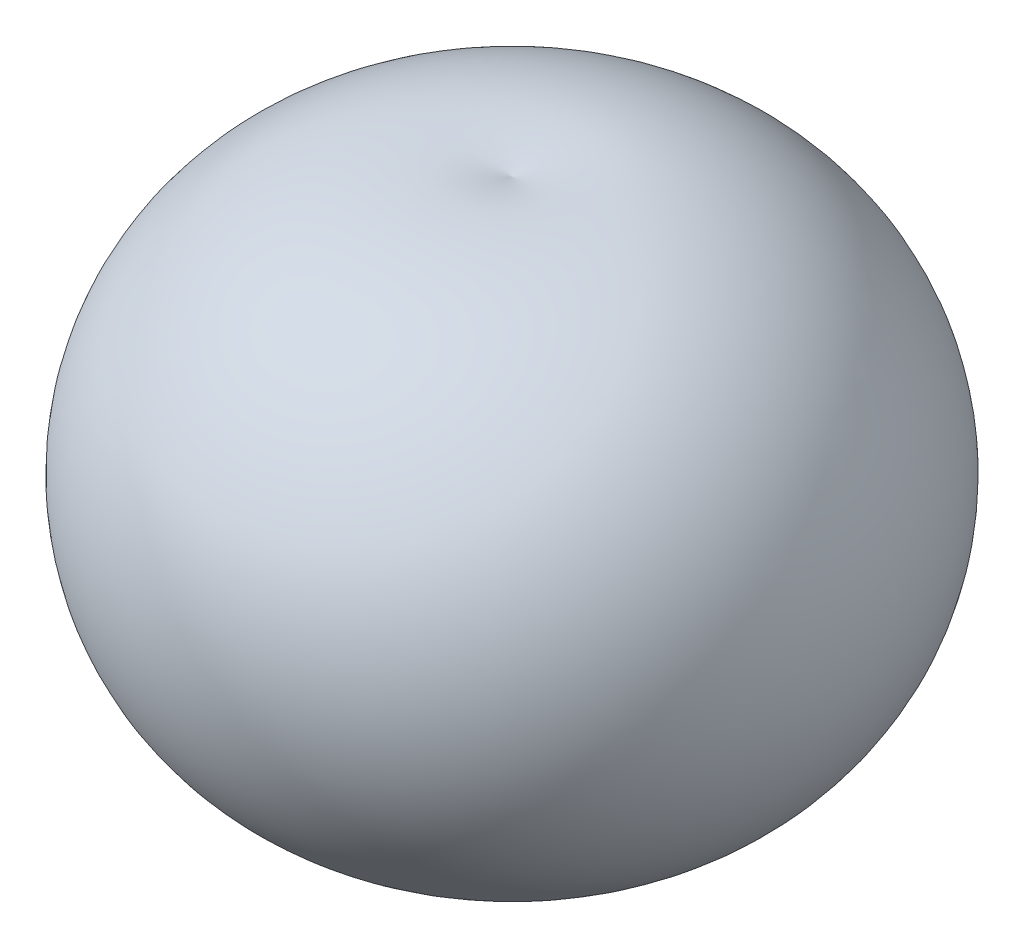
SolidWorks part; units mm, degrees
ref_plane "前视基准面" through (0, 0, 0) normal (0, 0, 1) x (1, 0, 0)
ref_plane "上视基准面" through (0, 0, 0) normal (0, 1, 0) x (1, 0, 0)
ref_plane "右视基准面" through (0, 0, 0) normal (1, 0, 0) x (0, 0, -1)
sketch "草图1" plane through (0, 0, 0) normal (0, 0, 1) x (1, 0, 0)
  line L0 (0, 0) -> (0, 356) construction
  line L1 (0, 356) -> (-500, 356) construction
  line L2 (-500, 356) -> (-500, 966) construction
  line L3 (-500, 356) -> (61.508, 594.346) construction
  line L4 (-500, 356) -> (-805, -172.2755) construction
  line L5 (-500, 966) -> (-1955, 966) construction
  line L6 (61.508, 594.346) -> (-507.0058, 1933.6806) construction
  line L7 (61.508, 594.346) -> (388.8117, -823.3625) construction
  line L8 (-805, -172.2755) -> (455.067, -899.7755) construction
  line L9 (-805, -172.2755) -> (372.1197, 682.952) construction
  line L10 (61.508, 594.346) -> (-1393.2704, 619.7392) construction
  line L11 (-805, -172.2755) -> (-1919.5947, 762.9805) construction
  line L12 (0, 2949.6721) -> (0, -2083.0102) construction
  line L13 (0, 1745.5618) -> (0, 2359.5531)
  line L14 (0, -1384.2986) -> (0, -429.8056)
  arc A0 (388.8117, -823.3625) -> (1400.8425, 1162.8598) centre (61.508, 594.346) ccw construction
  arc A2 (1400.8425, 1162.8598) -> (-1532.5, -1432.3425) centre (-500, 356) ccw construction
  arc A3 (-1393.2704, 619.7392) -> (0, -429.8056) centre (-500, 356) ccw
  arc A4 (-730.9418, 1814.6117) -> (-1393.2704, 619.7392) centre (61.508, 594.346) ccw
  arc A5 (245.4485, -202.3879) -> (372.1197, 682.952) centre (-500, 356) ccw construction
  arc A6 (0, 2359.5531) -> (-1532.5, -1432.3425) centre (-500, 356) ccw
  arc A7 (388.8117, -823.3625) -> (562.2528, -669.9148) centre (-500, 356) ccw construction
  arc A8 (0, 1745.5618) -> (-730.9418, 1814.6117) centre (-500, 356) ccw
  arc A9 (-1532.5, -1432.3425) -> (0, -1384.2986) centre (-805, -172.2755) ccw
  point P19 (-1393.2704, 619.7392)
  point P23 (0, 1584.1336)
  dimension "D7" = 66
  dimension "D9" = 66
  dimension "D11" = 2065
  dimension "D12" = 1455
  dimension "D1" = 356
  dimension "D2" = 500
  dimension "D3" = 610
  dimension "D4" = 67
  dimension "D5" = 150
  dimension "D6" = 1455
  dimension "D8" = 190
  dimension "D10" = 190
revolve "旋转1" add sketch "草图1" angle 360 about L12
